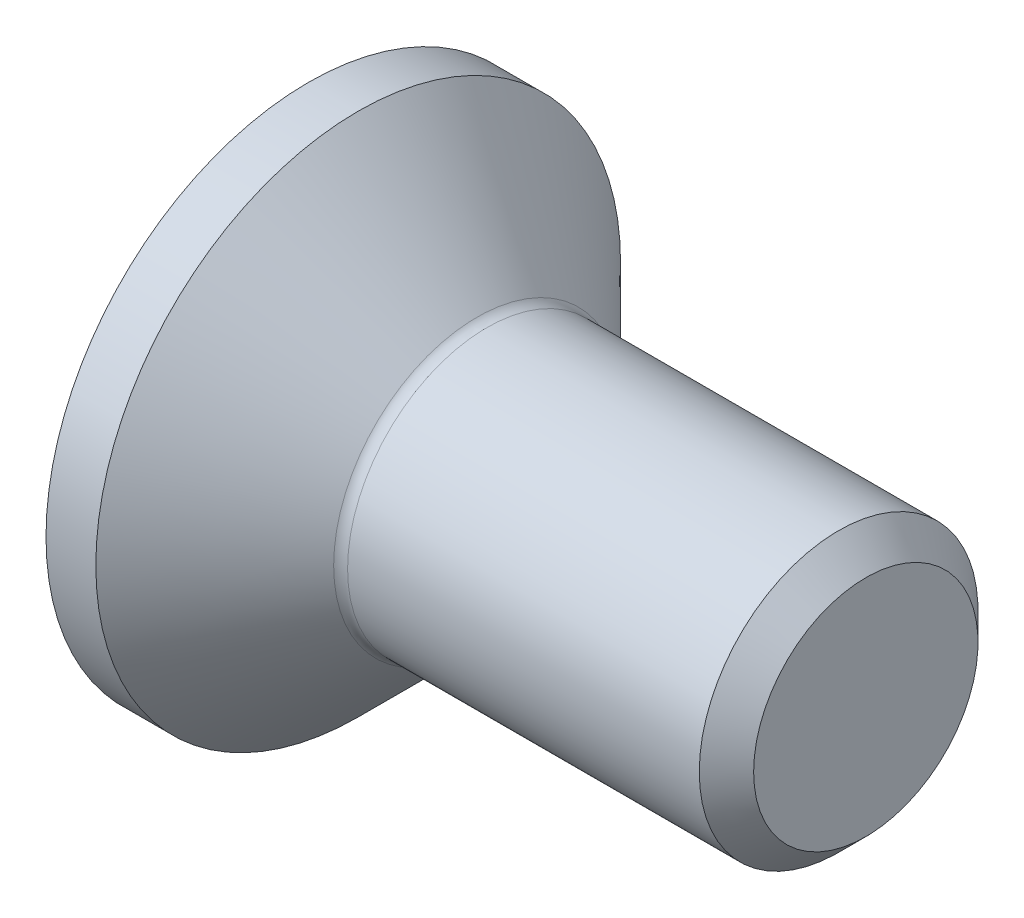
SolidWorks part; units mm, degrees
ref_plane "Plane1" through (0, 0, 0) normal (0, 0, 1) x (1, 0, 0)
ref_plane "Plane2" through (0, 0, 0) normal (0, 1, 0) x (1, 0, 0)
ref_plane "Plane3" through (0, 0, 0) normal (1, 0, 0) x (0, 0, -1)
sketch "BodySke" plane through (0, 0, 0) normal (0, 0, 1) x (1, 0, 0)
  line L0 (0, 0) -> (0, 3.765)
  line L1 (0.715, 3.765) -> (2.48, 2)
  line L2 (0, 3.765) -> (0.715, 3.765)
  line L3 (2.48, 2) -> (7.61, 2)
  line L4 (8, 1.61) -> (8, 0)
  line L5 (8, 0) -> (0, 0)
  line L6 (0, 0) -> (127, 0) construction
  line L7 (0.715, -3.765) -> (2.48, -2) construction
  line L8 (8, 1.61) -> (7.61, 2)
  line L9 (0, -3.765) -> (0.715, -3.765) construction
  line L10 (8, -1.61) -> (7.61, -2) construction
  line L11 (3.18, 8.35) -> (3.18, -13.875) construction
  line L12 (0, 19.05) -> (0, -3.175) construction
  dimension "D1" = 0.715
  dimension "Diameter" = 4
  dimension "Head_ht" = 2.48
  dimension "Length" = 8
  dimension "Body_ch_ang" = 45
  dimension "Head_dia" = 7.53
  dimension "Minor_dia" = 3.22
  dimension "Head_ang" = 90
  dimension "Advance" = 0.7
  dimension "Thread_nom" = 8
revolve "BaseBody" add sketch "BodySke"
fillet "Fillet1" radius 0.2 1 edges at (2.48, 0, 2)
sketch "Sketch2" plane through (0, 0, 0) normal (0, 0, 1) x (1, 0, 0)
  line L0 (0, 1.25) -> (1.5, 1.25)
  line L1 (1.5, 1.25) -> (2.2217, 0)
  line L2 (0, 0) -> (127, 0) construction
  line L3 (2.2217, 0) -> (0, 0)
  line L4 (0, 0) -> (0, 1.25)
  line L5 (0, -1.25) -> (1.5, -1.25) construction
  line L6 (0, 0) -> (47.625, 0) construction
  line L8 (0, 3.765) -> (0, -3.765) construction
  dimension "D2" = 60
  dimension "PreBroach_depth" = 1.5
  dimension "PreBroach_dia" = 2.5
revolve "PreBroach" cut sketch "Sketch2" angle 360 about L6
sketch "Sketch3" plane through (0, 0, 0) normal (-1, 0, 0) x (0, 0, 1)
  line L0 (-1.25, -0.7217) -> (-1.25, 0.7217)
  line L1 (-1.25, 0.7217) -> (0, 1.4434)
  line L2 (0, 1.4434) -> (1.25, 0.7217)
  line L3 (1.25, 0.7217) -> (1.25, -0.7217)
  line L4 (1.25, -0.7217) -> (0, -1.4434)
  line L5 (0, -1.4434) -> (-1.25, -0.7217)
  dimension "D1" = 1.25
  dimension "D2" = 1.25
  dimension "D3" = 2.5
  dimension "Hex_size" = 2.5
extrude "Hex" cut sketch "Sketch3" against normal blind 1.5
sketch "ThdSchSke" plane through (0, 0, 0) normal (0, 0, 1) x (1, 0, 0)
  line L0 (4.58, -1.61) -> (4.3069, -2)
  line L1 (4.58, -1.61) -> (4.8531, -2)
  line L2 (4.8531, -2) -> (4.8531, -2.5)
  line L3 (-3.175, 0) -> (5.1513, 0) construction
  line L4 (0, 3.765) -> (0, -3.765) construction
  line L5 (4.8531, -2.5) -> (4.3069, -2.5)
  line L6 (4.3069, -2.5) -> (4.3069, -2)
  dimension "Thread_minor" = 3.22
  dimension "Diameter" = 4
  dimension "Start" = 4.58
  dimension "SideAngle" = 55
  dimension "VeeAngle" = 70
  dimension "Overcut" = 5
revolve "ThreadSchematic" [suppressed] cut sketch "ThdSchSke" angle 360 about L3
pattern_linear "ThdSchPat" [suppressed]
equation "\"Thread_minor@ThreadCosmetic\"  =  \"Minor_dia@BodySke\""
equation "\"D1@Sketch3\" = \"Hex_size@Sketch3\" / 2"
equation "\"D2@Sketch3\" = \"D1@Sketch3\""
equation "\"D3@Sketch3\" = \"Hex_size@Sketch3\""
equation "\"Thread_length@ThreadCosmetic\" = ((sgn( (\"Length@BodySke\" - \"Advance@BodySke\" * 3.0 - \"Head_ht@BodySke\" ) - \"Thread_nom@BodySke\" )-1)*( (\"Length@BodySke\" - \"Advance@BodySke\" * 3.0 - \"Head_ht@BodySke\" "
equation "\"Thread_minor@ThdSchSke\" = \"Minor_dia@BodySke\""
equation "\"Diameter@ThdSchSke\" = \"Diameter@BodySke\""
equation "\"Overcut@ThdSchSke\" = \"Diameter@BodySke\" * 1.25"
equation "\"Start@ThdSchSke\" = 0.000001 + \"Length@BodySke\" - \"Thread_length@ThreadCosmetic\"  '---Countersunk---"
equation "\"Num_threads@ThdSchPat\" = int( \"Thread_length@ThreadCosmetic\" / \"Advance@BodySke\" + 0.999 )  + 1"
equation "\"Advance@ThdSchPat\" = \"Thread_length@ThreadCosmetic\" /  (\"Num_threads@ThdSchPat\" - 1) 'relax it"
equation "\"Num_threads@ThdSchPat\" = \"Num_threads@ThdSchPat\" - sgn( \"Num_threads@ThdSchPat\" - 1) '---chamfered tips only---"
